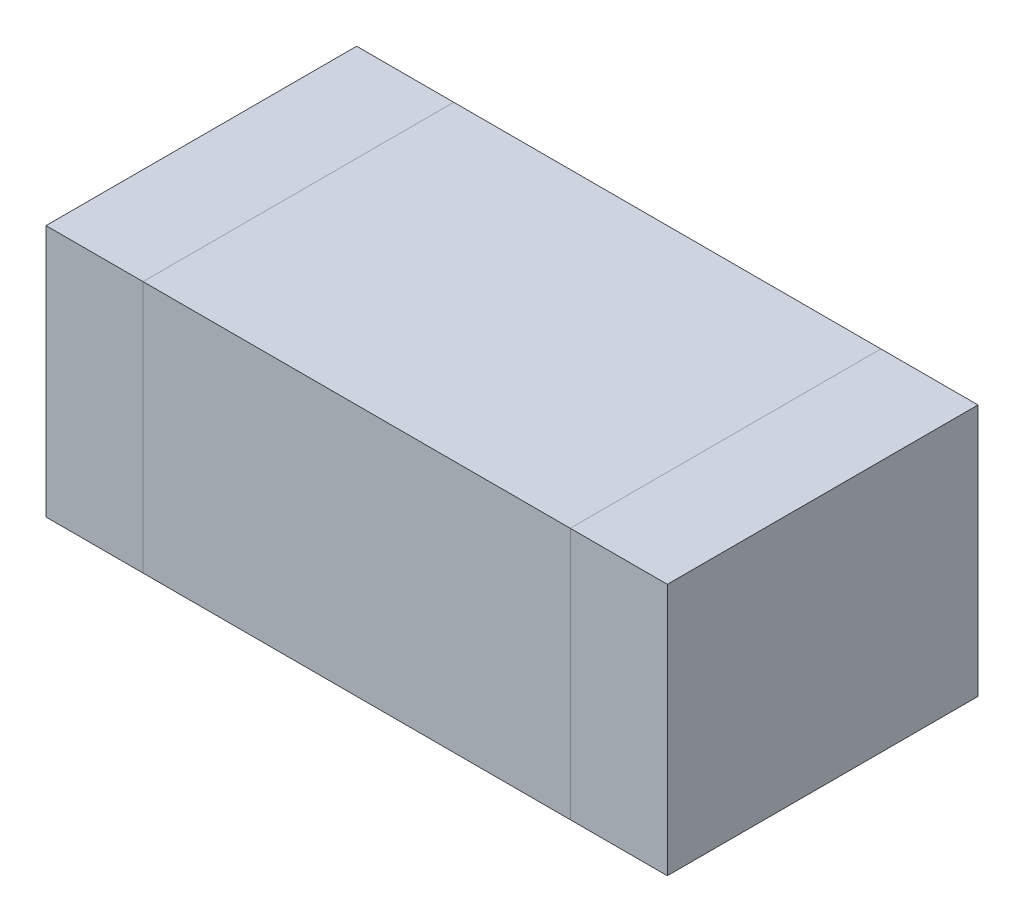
SolidWorks part; units mm, degrees
ref_plane "Front Plane" through (0, 0, 0) normal (0, 0, 1) x (1, 0, 0)
ref_plane "Top Plane" through (0, 0, 0) normal (0, 1, 0) x (1, 0, 0)
ref_plane "Right Plane" through (0, 0, 0) normal (1, 0, 0) x (0, 0, -1)
sketch "Sketch1" plane through (0, 0, 0) normal (0, 1, 0) x (1, 0, 0)
  line L1 (0, 0) -> (3.2, 0)
  line L2 (0, 0) -> (0, 1.6)
  line L3 (0, 1.6) -> (3.2, 1.6)
  line L4 (3.2, 0) -> (3.2, 1.6)
extrude "Boss-Extrude1" add sketch "Sketch1" along normal blind 1.3
sketch "Sketch2" plane through (0, 1.3, 0) normal (0, 1, 0) x (1, 0, 0)
  line L0 (0, 0) -> (3.2, 0) construction
  line L1 (0, 1.6) -> (0.5, 1.6)
  line L2 (0, 1.6) -> (0, 0)
  line L3 (0, 0) -> (0.5, 0)
  line L4 (0.5, 1.6) -> (0.5, 0)
  line L6 (3.2, 1.6) -> (2.7, 1.6)
  line L7 (3.2, 1.6) -> (3.2, 0)
  line L8 (3.2, 0) -> (2.7, 0)
  line L9 (2.7, 1.6) -> (2.7, 0)
split "Split1" trim tools "Sketch2" bodies to split 101 resulting bodies 102 103 104
